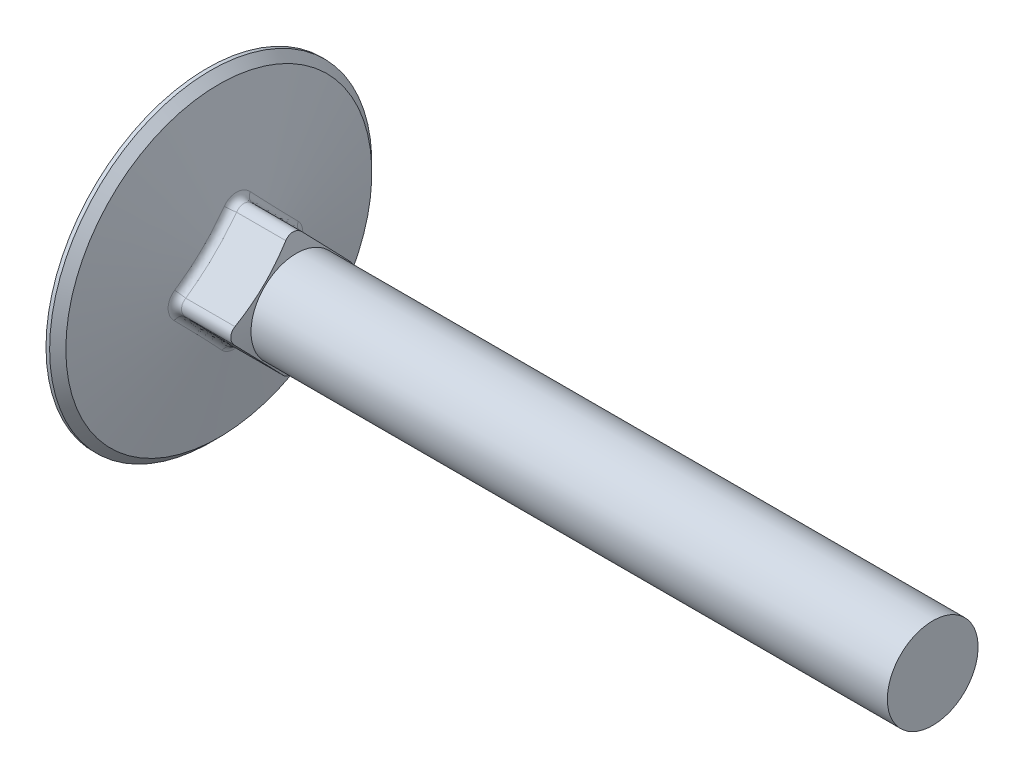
SolidWorks part; units mm, degrees
ref_plane "Plane1" through (0, 0, 0) normal (0, 0, 1) x (1, 0, 0)
ref_plane "Plane2" through (0, 0, 0) normal (0, 1, 0) x (1, 0, 0)
ref_plane "Plane3" through (0, 0, 0) normal (1, 0, 0) x (0, 0, -1)
sketch "BodySke" plane through (0, 0, 0) normal (0, 0, 1) x (1, 0, 0)
  line L0 (0, 0) -> (0, 16.9164)
  line L1 (0, 16.9164) -> (0.381, 16.9164)
  line L2 (3.429, 4.7625) -> (76.2, 4.7625)
  line L3 (76.2, 4.7625) -> (76.2, 0)
  line L4 (76.2, 0) -> (0, 0)
  line L5 (-6.35, 0) -> (82.55, 0) construction
  line L6 (3.429, -4.7625) -> (76.2, -4.7625) construction
  line L7 (0, -16.9164) -> (0.381, -16.9164) construction
  line L8 (1.2319, 16.0655) -> (3.429, 4.7625)
  line L9 (74.6125, 12.7) -> (74.6125, -3.175) construction
  line L10 (0.381, 16.9164) -> (1.2319, 16.0655)
  line L11 (38.1, 12.7) -> (38.1, -3.175) construction
  dimension "D1" = 0.381
  dimension "Diameter" = 9.525
  dimension "D2" = 45
  dimension "Length" = 76.2
  dimension "Head_ht" = 3.429
  dimension "Head_dia" = 33.8328
  dimension "Head_ang" = 11
  dimension "Advance" = 1.5875
  dimension "Thread_nom" = 38.1
revolve "BaseBody" add sketch "BodySke"
revolve "NeckChamfer" cut sketch "Sketch3" angle 360 about L4
sketch "Sketch3" plane through (0, 0, 0) normal (0, 0, 1) x (1, 0, 0)
  line L0 (2.713, 29.6164) -> (9.3726, 4.7625)
  line L1 (9.3726, 4.7625) -> (9.6266, 4.7625)
  line L2 (9.6266, 4.7625) -> (9.6266, 29.6164)
  line L3 (9.6266, 29.6164) -> (2.713, 29.6164)
  line L4 (0, 0) -> (22.225, 0) construction
  line L9 (0.381, 16.9164) -> (0, 16.9164) construction
  dimension "D1" = 12.7
  dimension "D2" = 4.7625
  dimension "D3" = 105
  dimension "D4" = 0.254
  dimension "D5" = 9.3726
sketch "Sketch2" plane through (0, 0, 0) normal (1, 0, 0) x (0, 0.6947, -0.7193)
  line L1 (3.7084, -4.9022) -> (-3.7084, -4.9022)
  line L2 (4.9022, -3.7084) -> (4.9022, 3.7084)
  line L3 (3.7084, 4.9022) -> (-3.7084, 4.9022)
  line L4 (-4.9022, -3.7084) -> (-4.9022, 3.7084)
  arc A0 (3.7084, 4.9022) -> (4.9022, 3.7084) centre (3.7084, 3.7084) cw
  arc A1 (3.7084, -4.9022) -> (4.9022, -3.7084) centre (3.7084, -3.7084) ccw
  arc A2 (-4.9022, -3.7084) -> (-3.7084, -4.9022) centre (-3.7084, -3.7084) ccw
  arc A3 (-3.7084, 4.9022) -> (-4.9022, 3.7084) centre (-3.7084, 3.7084) ccw
  dimension "Neck_corner_radius" = 1.1938
  dimension "D1" = 4.9022
  dimension "Neck_width" = 9.8044
  dimension "D2" = 9.8044
  dimension "D3" = 4.9022
extrude "Neck" add sketch "Sketch2" along normal blind 9.3726
fillet "HeadFillet" radius 0.7874 8 edges at (3.283, 1.5902, -5.2793) (3.1045, 0.0247, -6.4318) (3.283, -5.2793, -1.5902) (3.1045, -6.4318, -0.0247) (3.283, -1.5902, 5.2793) (3.1045, -0.0247, 6.4318) (3.283, 5.2793, 1.5902) (3.1045, 6.4318, 0.0247)
sketch "ThdSchSke" plane through (0, 0, 0) normal (0, 0, 1) x (1, 0, 0)
  line L0 (38.1, -3.8163) -> (37.4375, -4.7625)
  line L1 (38.1, -3.8163) -> (38.7625, -4.7625)
  line L2 (38.7625, -4.7625) -> (38.7625, -5.9531)
  line L3 (-3.175, 0) -> (5.1513, 0) construction
  line L5 (38.7625, -5.9531) -> (37.4375, -5.9531)
  line L6 (37.4375, -5.9531) -> (37.4375, -4.7625)
  line L7 (0, 16.9164) -> (0, -16.9164) construction
  dimension "Thread_minor" = 7.6327
  dimension "Diameter" = 9.525
  dimension "Start" = 38.1
  dimension "SideAngle" = 55
  dimension "VeeAngle" = 70
  dimension "Overcut" = 11.9063
revolve "ThreadSchematic" [suppressed] cut sketch "ThdSchSke" angle 360 about L3
pattern_linear "ThdSchPat" [suppressed]
equation "\"D1@Sketch2\" = \"Neck_width@Sketch2\"/2"
equation "\"D2@Sketch2\" = \"Neck_width@Sketch2\""
equation "\"D3@Sketch2\" = \"D2@Sketch2\"/2"
equation "\"D2@Sketch3\" = \"Diameter@BodySke\"/2"
equation "\"D5@Sketch3\" = \"Neck_ht@Neck\""
equation "\"Thread_length@ThreadCosmetic\" = ((sgn( (\"Length@BodySke\" - \"Advance@BodySke\" * 1.5 - \"Neck_ht@Neck\" ) - \"Thread_nom@BodySke\" )-1)*( (\"Length@BodySke\" - \"Advance@BodySke\" * 1.5 - \"Neck_ht@Neck\" ) - \"T"
equation "\"Thread_minor@ThdSchSke\" = \"Thread_minor@ThreadCosmetic\""
equation "\"Diameter@ThdSchSke\" = \"Diameter@BodySke\""
equation "\"Overcut@ThdSchSke\" = \"Diameter@BodySke\" * 1.25"
equation "\"Start@ThdSchSke\" = 0.000001 + \"Length@BodySke\" - \"Thread_length@ThreadCosmetic\"  '---Countersunk---"
equation "\"Num_threads@ThdSchPat\" = int( \"Thread_length@ThreadCosmetic\" / \"Advance@BodySke\" + 0.999 )  + 1"
equation "\"Advance@ThdSchPat\" = \"Thread_length@ThreadCosmetic\" /  (\"Num_threads@ThdSchPat\" - 1) 'relax it"
